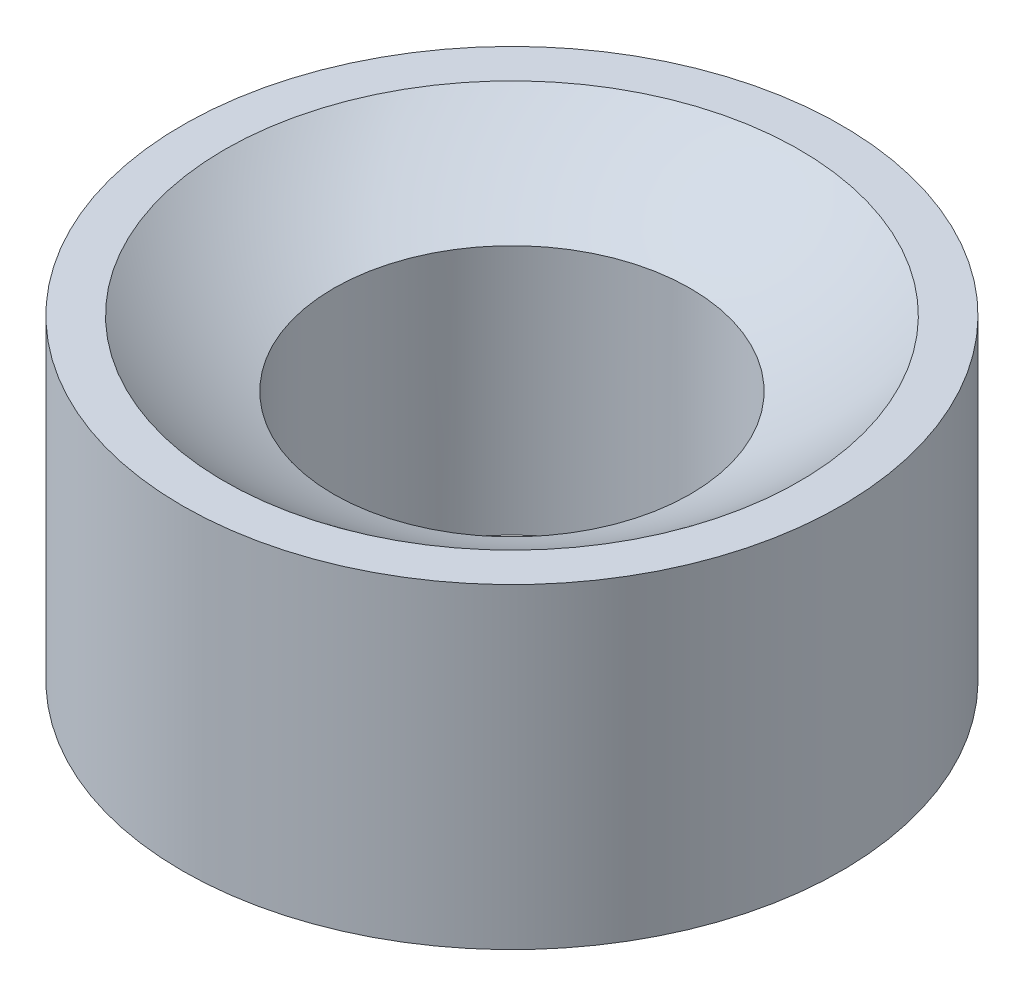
SolidWorks part; units mm, degrees
ref_plane "Plan1" through (0, 0, 0) normal (0, 0, 1) x (1, 0, 0)
ref_plane "Plan2" through (0, 0, 0) normal (0, 1, 0) x (1, 0, 0)
ref_plane "Plan3" through (0, 0, 0) normal (1, 0, 0) x (0, 0, -1)
sketch "Esquisse2" plane through (0, 0, 0) normal (0, 0, 1) x (1, 0, 0)
  line L0 (474.9402, 265.5785) -> (474.9402, 248.3133) construction
  line L1 (468.5802, 254.3031) -> (468.5802, 263.2385)
  line L4 (463.1862, 265.5785) -> (464.6902, 265.5785)
  line L5 (463.1862, 254.3031) -> (468.5802, 254.3031)
  line L7 (463.1862, 254.3031) -> (463.1862, 265.5785)
  arc A0 (468.5802, 263.2385) -> (464.6902, 265.5785) centre (474.9402, 278.2147) cw
  dimension "D1" = 10.25
  dimension "D2" = 6.36
revolve "Base-Révolution" add sketch "Esquisse2" angle 360 about L0
